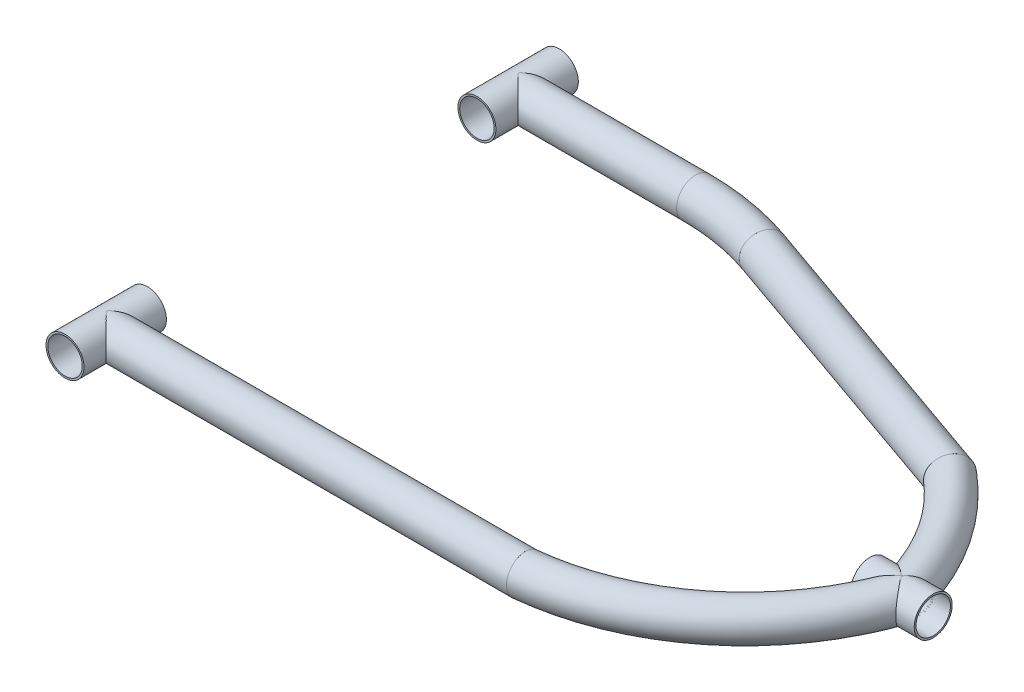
SolidWorks part; units mm, degrees
ref_plane "Front Plane" through (0, 0, 0) normal (0, 0, 1) x (1, 0, 0)
ref_plane "Top Plane" through (0, 0, 0) normal (0, 1, 0) x (1, 0, 0)
ref_plane "Right Plane" through (0, 0, 0) normal (1, 0, 0) x (0, 0, -1)
sketch "Sketch1" plane through (0, 0, 0) normal (0, 1, 0) x (1, 0, 0)
  line L11 (0, 674.8336) -> (0, 731.9836) construction
  line L12 (0, 674.8336) -> (0, 827.2336) construction
  line L13 (0, 833.5836) -> (0, 874.8586) construction
  line L16 (0, 731.9836) -> (330.2, 731.9836) construction
  line L17 (0, 627.2086) -> (0, 668.4836) construction
  line L18 (0, 627.2086) -> (0, 668.4836) construction
  line L19 (129.8422, 847.2566) -> (273.6704, 796.8663)
  line L20 (0, 854.2211) -> (88.9, 854.2211)
  line L21 (0, 647.8461) -> (209.55, 647.8461)
  line L22 (330.2, 731.9836) -> (298.45, 731.9836)
  line L23 (0, 874.8586) -> (0, 833.5836)
  line L24 (0, 627.2086) -> (0, 668.4836)
  arc A3 (88.9, 854.2211) -> (129.8422, 847.2566) centre (88.9, 730.3961) cw
  arc A4 (314.325, 731.9836) -> (273.6704, 796.8663) centre (194.2102, 701.8994) ccw
  arc A5 (209.55, 647.8461) -> (314.325, 731.9836) centre (196.8123, 771.0142) ccw
  point P42 (109.9634, 854.2211)
other "Structural Member1"
ref_plane "Plane2" through (0, 0, -627.2086) normal (0, 0, -1) x (-1, 0, 0)
sketch "Sketch12" plane through (0, 0, -627.2086) normal (0, 0, -1) x (-1, 0, 0)
  circle A0 centre (0, 0) radius 8.636
  circle A1 centre (0, 0) radius 9.525
  point P5 (0, 0)
  dimension "Out_dia" = 19.05
  dimension "D1" = 0.889
other "Structural Member2"
ref_plane "Plane3" through (0, 0, -647.8461) normal (1, 0, 0) x (0, 0, -1)
sketch "Sketch13" plane through (0, 0, -647.8461) normal (1, 0, 0) x (0, 0, -1)
  circle A0 centre (0, 0) radius 8.636
  circle A1 centre (0, 0) radius 9.525
  point P5 (0, 0)
  dimension "Out_dia" = 19.05
  dimension "D1" = 0.889
other "Structural Member3"
ref_plane "Plane4" through (330.2, 0, -731.9836) normal (-1, 0, 0) x (0, 0, 1)
sketch "Sketch14" plane through (330.2, 0, -731.9836) normal (-1, 0, 0) x (0, 0, 1)
  circle A0 centre (0, 0) radius 8.636
  circle A1 centre (0, 0) radius 9.525
  point P5 (0, 0)
  dimension "Out_dia" = 19.05
  dimension "D1" = 0.889
sketch "Sketch15" plane through (330.2, 0, 0) normal (1, 0, 0) x (0, 0, -1)
  circle A0 centre (731.9836, 0) radius 8.636 construction
  circle A1 centre (731.9836, 0) radius 8.636
extrude "Cut-Extrude1" cut sketch "Sketch15" against normal through all
sketch "Sketch18" plane through (0, 0, -627.2086) normal (0, 0, 1) x (1, 0, 0)
  circle A0 centre (0, 0) radius 8.636 construction
  circle A1 centre (0, 0) radius 8.636
extrude "Cut-Extrude4" cut sketch "Sketch18" against normal through all
